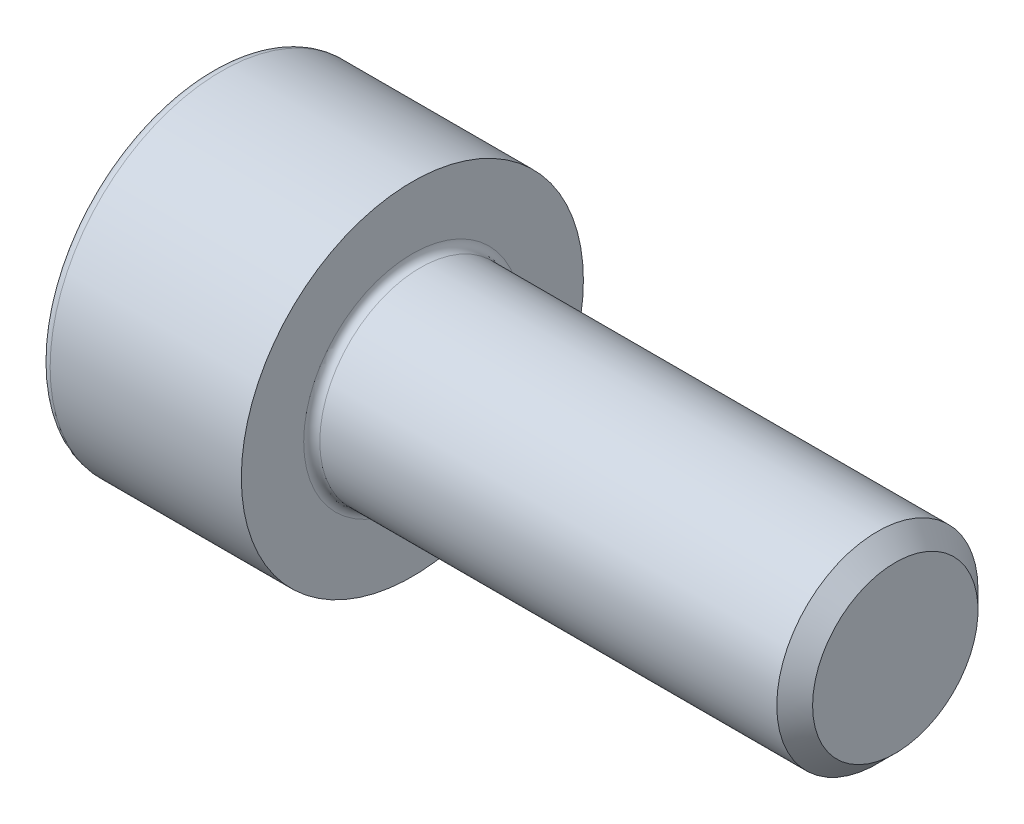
SolidWorks part; units mm, degrees
revolve "Base-Revolve" add sketch "BodySke"
sketch "BodySke" plane through (0, 0, 0) normal (0, 0, 1) x (1, 0, 0)
  line L0 (0, 0) -> (0, 4.25)
  line L1 (0, 4.25) -> (5, 4.25)
  line L2 (5, 4.25) -> (5, 2.5)
  line L3 (5, 2.5) -> (16.555, 2.5)
  line L4 (17, 2.055) -> (17, 0)
  line L5 (17, 0) -> (0, 0)
  line L6 (-31.75, 0) -> (127, 0) construction
  line L8 (17, 2.055) -> (16.555, 2.5)
  line L10 (17, -2.055) -> (16.555, -2.5) construction
  line L11 (5.8, 9.525) -> (5.8, 3.175) construction
  line L12 (5, 9.525) -> (5, 3.175) construction
  line L13 (-43, 9.525) -> (-43, 3.175) construction
fillet "Fillet1" radius 0.2 1 edges at (5, 0, 2.5)
fillet "Fillet2" radius 0.25 1 edges at (0, 0, 4.25)
ref_plane "Plane1" through (0, 0, 0) normal (0, 0, 1) x (1, 0, 0)
ref_plane "Plane2" through (0, 0, 0) normal (0, 1, 0) x (1, 0, 0)
ref_plane "Plane3" through (0, 0, 0) normal (1, 0, 0) x (0, 0, -1)
sketch "Sketch2" plane through (0, 0, 0) normal (0, 0, 1) x (1, 0, 0)
  line L0 (0, 2.042) -> (2.5, 2.042)
  line L1 (2.5, 2.042) -> (3.6789, 0)
  line L2 (-31.75, 0) -> (127, 0) construction
  line L3 (3.6789, 0) -> (0, 0)
  line L4 (0, 0) -> (0, 2.042)
  line L6 (0, 0) -> (47.625, 0) construction
revolve "Hex-PreBroach" cut sketch "Sketch2" angle 360 about L6
sketch "Sketch3" plane through (0, 0, 0) normal (-1, 0, 0) x (0, 0.5, 0.866)
  line L0 (1.1789, 2.042) -> (-1.1789, 2.042)
  line L1 (-1.1789, 2.042) -> (-2.3579, 0)
  line L2 (1.1789, 2.042) -> (2.3579, 0)
  line L3 (1.1789, -2.042) -> (2.3579, 0)
  line L4 (1.1789, -2.042) -> (-1.1789, -2.042)
  line L5 (-1.1789, -2.042) -> (-2.3579, 0)
extrude "Hex" cut sketch "Sketch3" against normal blind 2.5
sketch "ThdSchSke" plane through (0, 0, 0) normal (0, 0, 1) x (1, 0, 0)
  line L0 (7.4, -2.055) -> (7.0884, -2.5)
  line L1 (7.4, -2.055) -> (7.7116, -2.5)
  line L2 (7.7116, -2.5) -> (7.7116, -3.125)
  line L3 (-3.175, 0) -> (5.1513, 0) construction
  line L4 (0, 4) -> (0, -4) construction
  line L5 (7.7116, -3.125) -> (7.0884, -3.125)
  line L6 (7.0884, -3.125) -> (7.0884, -2.5)
revolve "ThreadSchematic" [suppressed] cut sketch "ThdSchSke" angle 360 about L3
pattern_linear "ThdSchPat" [suppressed]
equation "\"D2@Sketch3\" = \"Hex_size@Sketch3\" / 2"
equation "\"D1@Sketch3\" = \"Hex_size@Sketch3\" / 2"
equation "\"D1@Sketch2\" = \"Hex_size@Sketch3\" / 2"
equation "\"Thread_minor@ThreadCosmetic\"  =  \"Minor_dia@BodySke\""
equation "\"Depth@Sketch2\" =  \"Key_eng@Hex\""
equation "\"Thread_length@ThreadCosmetic\" = ((sgn( (\"Length@BodySke\" - \"Advance@BodySke\" * 3.0) - \"Thread_nom@BodySke\" )-1)*( (\"Length@BodySke\" - \"Advance@BodySke\" * 3.0) - \"Thread_nom@BodySke\" ))/-2+ \"Thread_no"
equation "\"Thread_minor@ThdSchSke\" = \"Minor_dia@BodySke\""
equation "\"Diameter@ThdSchSke\" = \"Diameter@BodySke\""
equation "\"Overcut@ThdSchSke\" = \"Diameter@BodySke\" * 1.25"
equation "\"Start@ThdSchSke\" = \"Head_ht@BodySke\" + \"Length@BodySke\" - \"Thread_length@ThreadCosmetic\"  '---Non-countersunk---"
equation "\"Num_threads@ThdSchPat\" = int( \"Thread_length@ThreadCosmetic\" / \"Advance@BodySke\" + 0.999 )  + 1"
equation "\"Advance@ThdSchPat\" = \"Thread_length@ThreadCosmetic\" /  (\"Num_threads@ThdSchPat\" - 1) 'relax it"
equation "\"Num_threads@ThdSchPat\" = \"Num_threads@ThdSchPat\" - sgn( \"Num_threads@ThdSchPat\" - 1) '---chamfered tips only---"
